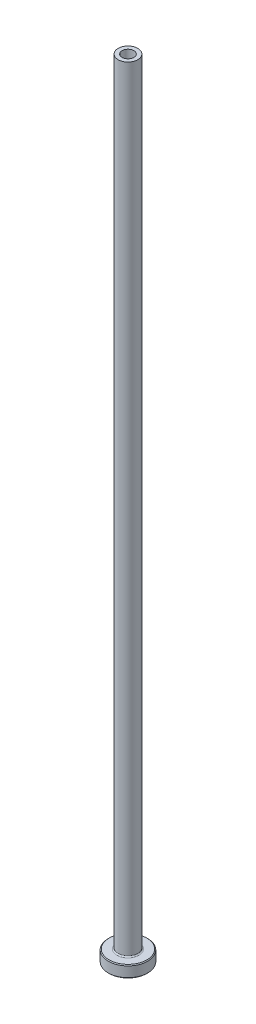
SolidWorks part; units mm, degrees
ref_plane "Front Plane" through (0, 0, 0) normal (0, 0, 1) x (1, 0, 0)
ref_plane "Top Plane" through (0, 0, 0) normal (0, 1, 0) x (1, 0, 0)
ref_plane "Right Plane" through (0, 0, 0) normal (1, 0, 0) x (0, 0, -1)
sketch "Sketch1" plane through (0, 0, 0) normal (0, 0, 1) x (1, 0, 0)
  line L0 (-1.5, 200) -> (-2.5, 200)
  line L1 (-2.5, 200) -> (-2.5, 3)
  line L2 (-2.5, 3) -> (-5, 3)
  line L3 (-5, 3) -> (-5, 0)
  line L4 (5.5, 0) -> (-5.5, 0) construction
  line L5 (-5, 0) -> (-1.75, 0)
  line L6 (-1.5, 155) -> (-1.5, 200)
  line L7 (0, 92.1877) -> (0, -15.5353) construction
  line L8 (0, -5.5) -> (0, 5.5) construction
  line L9 (-1.5, 155) -> (-1.75, 143)
  line L10 (-1.75, 143) -> (-1.75, 0)
  dimension "D1" = 0.25
  dimension "ID" = 3
  dimension "OD" = 5
  dimension "L" = 200
  dimension "H" = 10
  dimension "T" = 3
  dimension "N" = 45
  dimension "D2" = 12
revolve "Revolve1" add sketch "Sketch1" angle 360 about L7
fillet "Fillet1" radius 0.3 1 edges at (0, 3, 2.5)
chamfer "Chamfer1" distance 0.2 angle 45 2 edges at (0, 3, 5) (0, 0, 5)
chamfer "Chamfer3" distance 0.5 angle 45 1 edges at (0, 0, 1.75)
